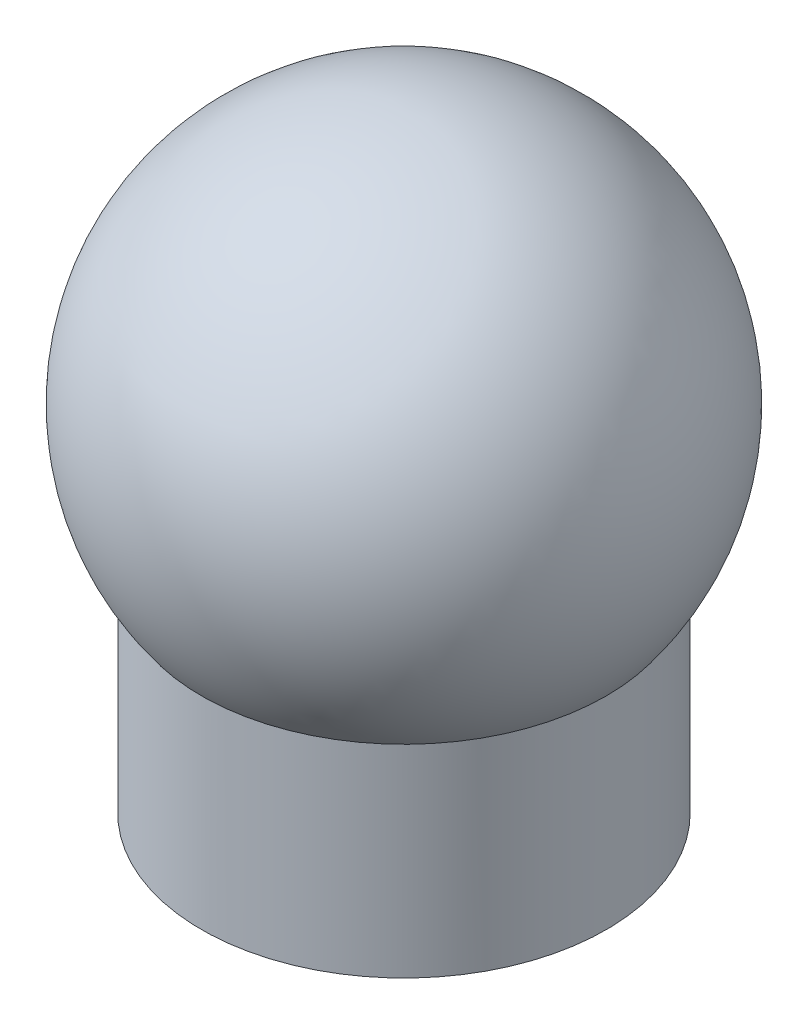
SolidWorks part; units mm, degrees
ref_plane "Plane1" through (0, 0, 0) normal (0, 0, 1) x (1, 0, 0)
ref_plane "Plane2" through (0, 0, 0) normal (0, 1, 0) x (1, 0, 0)
ref_plane "Plane3" through (0, 0, 0) normal (1, 0, 0) x (0, 0, -1)
sketch "Sketch1" plane through (0, 0, 0) normal (0, 0, 1) x (1, 0, 0)
  line L0 (0, 0) -> (0, 15.24) construction
  line L1 (0, 0) -> (5.08, 0)
  line L2 (5.08, 0) -> (5.08, 5.08)
  line L3 (0, 0) -> (0, 15.24)
  arc A0 (5.08, 5.08) -> (0, 15.24) centre (0, 8.89) ccw
  dimension "D3" = 6.35
  dimension "D1" = 5.08
  dimension "D2" = 10.16
revolve "Base-Revolve" add sketch "Sketch1" angle 360 about L0
